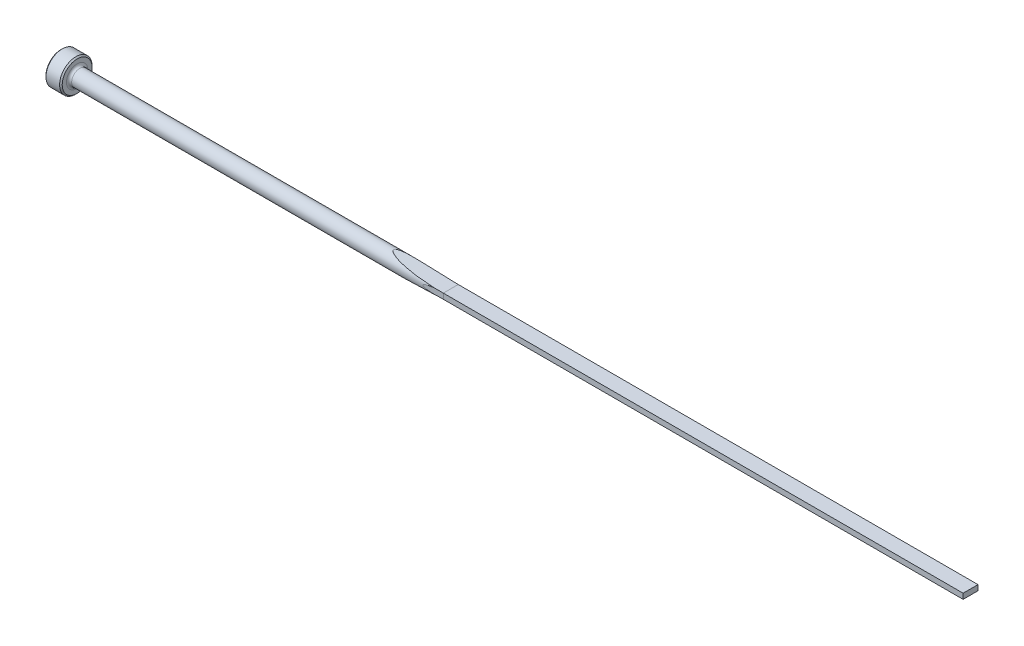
SolidWorks part; units mm, degrees
ref_plane "Front Plane" through (0, 0, 0) normal (0, 0, 1) x (1, 0, 0)
ref_plane "Top Plane" through (0, 0, 0) normal (0, 1, 0) x (1, 0, 0)
ref_plane "Right Plane" through (0, 0, 0) normal (1, 0, 0) x (0, 0, -1)
sketch "Sketch1" plane through (0, 0, 0) normal (0, 0, 1) x (1, 0, 0)
  line L0 (0, 0) -> (167.7268, 0) construction
  line L1 (0, 0) -> (0, 4.7625)
  line L2 (0, 4.7625) -> (4.7498, 4.7625)
  line L3 (4.7498, 4.7625) -> (4.7498, 2.3749)
  line L4 (4.7498, 2.3749) -> (266.7, 2.3749)
  line L5 (266.7, 2.3749) -> (266.7, 0)
  line L6 (266.7, 0) -> (0, 0)
  dimension "D1" = 266.7
  dimension "D2" = 9.525
  dimension "D3" = 4.7498
  dimension "D4" = 4.7498
revolve "Revolve1" add sketch "Sketch1" angle 360 about L0
sketch "Sketch2" plane through (0, 0, 0) normal (0, 0, 1) x (1, 0, 0)
  line L0 (266.7, 2.3749) -> (266.7, 0.7874)
  line L1 (266.7, -2.3749) -> (266.7, 2.3749) construction
  line L2 (266.7, 0.7874) -> (114.3, 0.7874)
  line L3 (266.7, 2.3749) -> (4.7498, 2.3749) construction
  line L4 (97.5746, 2.3749) -> (266.7, 2.3749)
  line L5 (166.0833, 0) -> (153.1705, 0) construction
  arc A0 (114.3, 0.7874) -> (97.5746, 2.3749) centre (114.3, 89.6874) cw
  dimension "D1" = 88.9
  dimension "D3" = 152.4
  dimension "D2" = 1.5748
  dimension "D4" = 16.7254
extrude "Cut-Extrude1" cut sketch "Sketch2" against normal through all both and the other way through all
mirror "Mirror1" about plane through (0, 0, 0) normal (0, 1, 0) of "Cut-Extrude1"
sketch "Sketch3" plane through (0, 0, 0) normal (0, 1, 0) x (1, 0, 0)
  line L0 (266.7, 2.3749) -> (266.7, 2.1844)
  line L1 (266.7, 2.2406) -> (266.7, -2.2406) construction
  line L2 (266.7, 2.1844) -> (114.3, 2.1844)
  line L3 (266.7, 2.3749) -> (4.7498, 2.3749) construction
  line L4 (108.4832, 2.3749) -> (266.7, 2.3749)
  line L5 (163.4716, 0) -> (166.2513, 0) construction
  line L6 (114.3, 2.2406) -> (114.3, -2.2406) construction
  arc A0 (114.3, 2.1844) -> (108.4832, 2.3749) centre (114.3, 91.0844) cw
  dimension "D2" = 88.9
  dimension "D1" = 4.3688
extrude "Cut-Extrude2" cut sketch "Sketch3" against normal through all both and the other way through all
mirror "Mirror2" about plane through (0, 0, 0) normal (0, 0, 1) of "Cut-Extrude2"
fillet "Fillet1" radius 0.762 1 edges at (4.7498, 0, 2.3749)
chamfer "Chamfer1" distance 0.381 angle 45 2 edges at (0, 0, 4.7625) (4.7498, 0, 4.7625)
